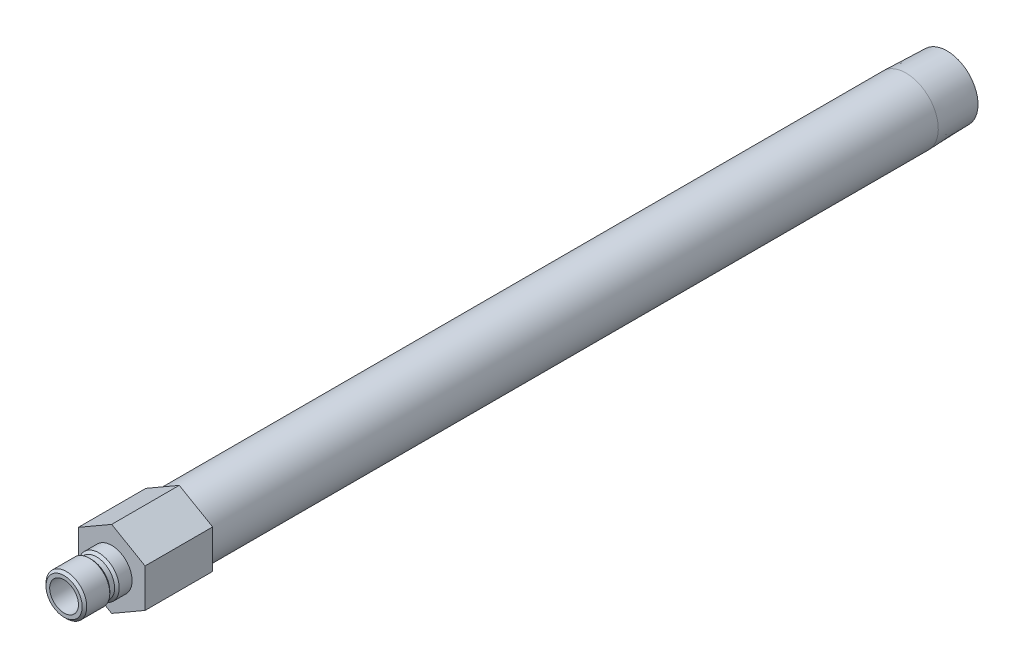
SolidWorks part; units mm, degrees
ref_plane "Front Plane" through (0, 0, 0) normal (0, 0, 1) x (1, 0, 0)
ref_plane "Top Plane" through (0, 0, 0) normal (0, 1, 0) x (1, 0, 0)
ref_plane "Right Plane" through (0, 0, 0) normal (1, 0, 0) x (0, 0, -1)
sketch "Sketch1" plane through (0, 0, 0) normal (1, 0, 0) x (0, 0, -1)
  line L0 (0, 0) -> (-18.923, 0) construction
  line L1 (-15.748, 4.7625) -> (-15.748, 5.9817)
  line L2 (-6.604, 5.9817) -> (-6.604, 0) construction
  line L3 (-14.986, 6.7437) -> (-7.366, 6.7437)
  line L4 (0, 10.668) -> (0, 0) construction
  line L5 (-6.604, 5.9817) -> (-5.0165, 5.9817)
  line L6 (-4.2545, 6.7437) -> (0, 6.7437)
  line L7 (0, 6.7437) -> (0, 10.668)
  line L8 (-6.604, 5.9817) -> (-7.366, 6.7437)
  line L9 (-5.0165, 5.9817) -> (-4.2545, 6.7437)
  line L10 (-15.748, 5.9817) -> (-14.986, 6.7437)
  line L11 (-15.748, 4.7625) -> (22.352, 4.7625)
  line L12 (0, 10.668) -> (262.7884, 10.668)
  line L13 (262.7884, 10.668) -> (276.352, 10.2441)
  line L14 (276.352, 10.2441) -> (276.352, 7.8994)
  line L15 (0, 6.7437) -> (22.352, 6.7437) construction
  line L16 (22.352, 6.7437) -> (22.352, 0) construction
  line L17 (22.352, 0) -> (0, 0) construction
  line L18 (22.352, 4.7625) -> (22.352, 7.8994)
  line L19 (22.352, 7.8994) -> (276.352, 7.8994)
  dimension "D1" = 15.748
  dimension "D2" = 1.5875
  dimension "D3" = 0.762
  dimension "D4" = 45
  dimension "D5" = 9.144
  dimension "D6" = 45
  dimension "D7" = 1.79
  dimension "D8" = 13.5636
  dimension "D9" = 292.1
  dimension "D10" = 3.175
  dimension "D11" = 9.525
  dimension "D12" = 21.336
  dimension "D13" = 38.1
  dimension "D14" = 13.4874
  dimension "D15" = 15.7988
revolve "Revolve1" add sketch "Sketch1" angle 360 about L0
sketch "Sketch2" plane through (0, 0, 0) normal (0, 0, 1) x (1, 0, 0)
  line L1 (-11.049, 6.3791) -> (-11.049, -6.3791)
  line L2 (-11.049, -6.3791) -> (0, -12.7583)
  line L3 (0, -12.7583) -> (11.049, -6.3791)
  line L4 (11.049, -6.3791) -> (11.049, 6.3791)
  line L5 (11.049, 6.3791) -> (0, 12.7583)
  line L6 (0, 12.7583) -> (-11.049, 6.3791)
  circle A0 centre (0, 0) radius 11.049 construction
  circle A1 centre (0, 0) radius 4.7625 construction
  circle A2 centre (0, 0) radius 4.7625
  dimension "D1" = 22.098
extrude "Boss-Extrude1" add sketch "Sketch2" against normal up to vertex (22.352 mm away) from vertex at 0
